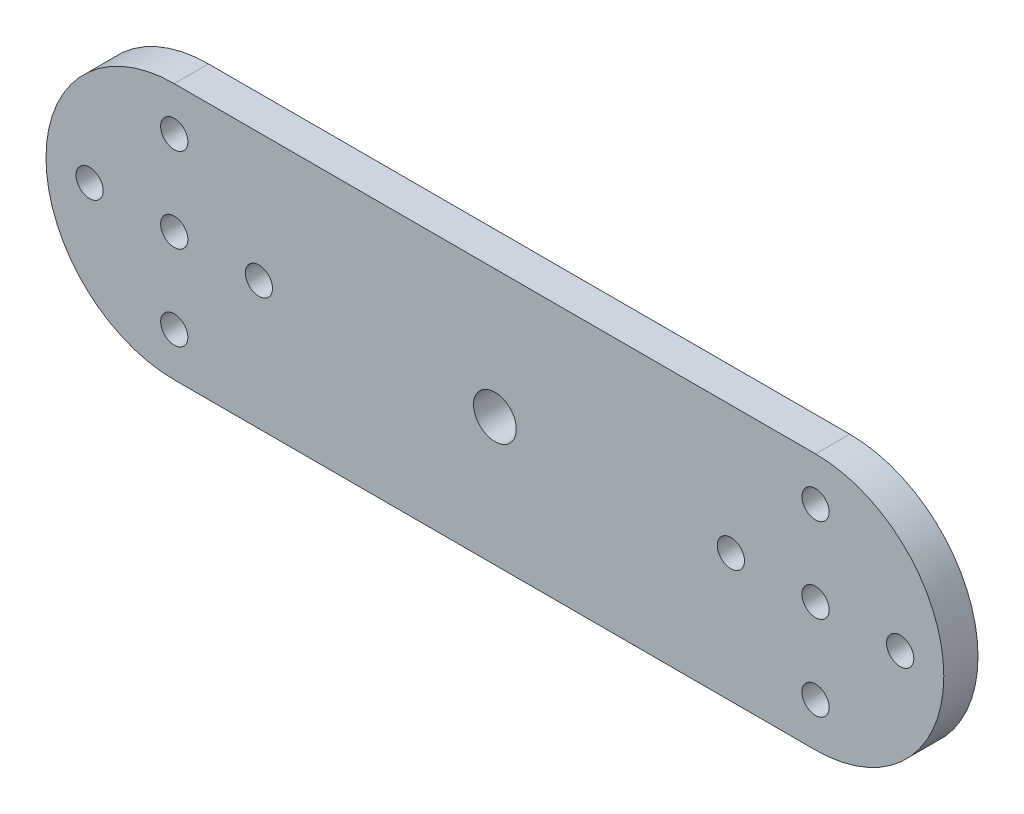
SolidWorks part; units mm, degrees
ref_plane "Front Plane" through (0, 0, 0) normal (0, 0, 1) x (1, 0, 0)
ref_plane "Top Plane" through (0, 0, 0) normal (0, 1, 0) x (1, 0, 0)
ref_plane "Right Plane" through (0, 0, 0) normal (1, 0, 0) x (0, 0, -1)
sketch "Sketch1" plane through (0, 0, 0) normal (0, 0, 1) x (1, 0, 0)
  line L0 (-37.5, 0) -> (37.5, 0) construction
  line L1 (-37.5, 15) -> (37.5, 15)
  line L2 (-37.5, -15) -> (37.5, -15)
  line L3 (37.5, 0) -> (47.4, 0) construction
  arc A0 (-37.5, 15) -> (-37.5, -15) centre (-37.5, 0) ccw
  arc A1 (37.5, -15) -> (37.5, 15) centre (37.5, 0) ccw
  circle A2 centre (-37.5, 0) radius 1.59
  circle A3 centre (37.5, 0) radius 1.59
  circle A4 centre (-47.4, 0) radius 1.59
  circle A5 centre (-37.5, 9.9) radius 1.59
  circle A6 centre (-27.6, 0) radius 1.59
  circle A7 centre (-37.5, -9.9) radius 1.59
  circle A8 centre (37.5, -9.9) radius 1.59
  circle A9 centre (27.6, 0) radius 1.59
  circle A10 centre (37.5, 9.9) radius 1.59
  circle A11 centre (47.4, 0) radius 1.59
  circle A14 centre (0, 0) radius 2.5
  point P2 (0, 0)
  point P23 (-37.5, 0)
  point P32 (0, 0)
  dimension "D3" = 3.18
  dimension "D4" = 9.9
  dimension "D7" = 5
  dimension "D1" = 75
  dimension "D2" = 30
  dimension "D5" = 4
  dimension "D6" = 2
extrude "Boss-Extrude1" add sketch "Sketch1" along normal blind 4
